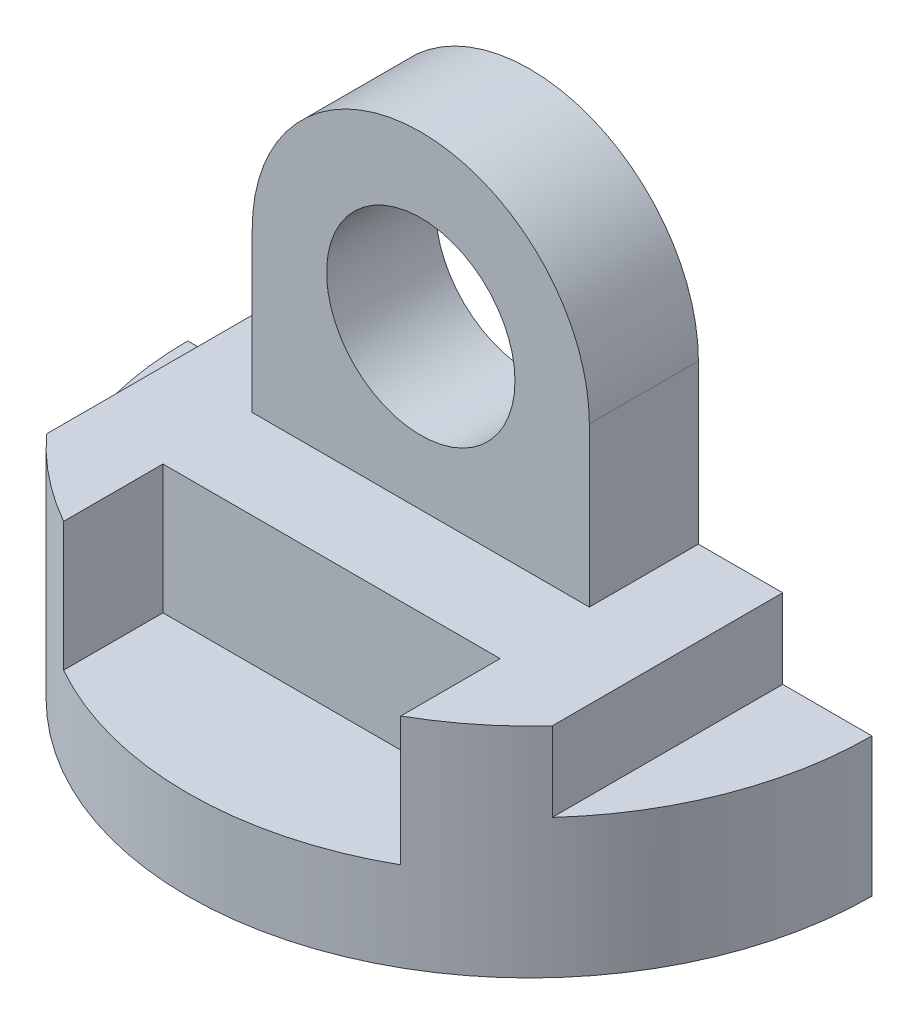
SolidWorks part; units mm, degrees
ref_plane "前视基准面" through (0, 0, 0) normal (0, 0, 1) x (1, 0, 0)
ref_plane "上视基准面" through (0, 0, 0) normal (0, 1, 0) x (1, 0, 0)
ref_plane "右视基准面" through (0, 0, 0) normal (1, 0, 0) x (0, 0, -1)
sketch "草图1" plane through (0, 0, 0) normal (0, 1, 0) x (1, 0, 0)
  line L0 (138, 0) -> (-138, 0)
  arc A0 (-138, 0) -> (138, 0) centre (0, 0) ccw
extrude "拉伸1" add sketch "草图1" along normal blind 88
sketch "草图2" plane through (0, 0, 0) normal (0, 0, 1) x (1, 0, 0)
  line L0 (138, 88) -> (-138, 88) construction
  line L1 (68, 88) -> (-68, 88)
  line L2 (68, 88) -> (68, 152)
  line L4 (-68, 88) -> (-68, 152)
  arc A0 (68, 152) -> (-68, 152) centre (0, 152) ccw
  dimension "D1" = 64
  dimension "D2" = 136
extrude "拉伸2" add sketch "草图2" along normal blind 44
sketch "草图3" plane through (0, 0, 44) normal (0, 0, 1) x (1, 0, 0)
  circle A0 centre (0, 152) radius 38
extrude "切除-拉伸3" cut sketch "草图3" against normal through all
sketch "草图4" plane through (0, 88, 0) normal (0, 1, 0) x (1, 0, 0)
  line L0 (-68, -80) -> (68, -80)
  line L1 (68, -80) -> (68, -157.9402)
  line L2 (68, -157.9402) -> (-68, -157.9402)
  line L3 (-68, -157.9402) -> (-68, -80)
  line L4 (0, -24.5189) -> (0, -58.3718) construction
  line L5 (-68, -44) -> (68, -44) construction
  dimension "D1" = 36
  dimension "D2" = 136
extrude "切除-拉伸4" cut sketch "草图4" against normal blind 52
sketch "草图5" plane through (0, 88, 0) normal (0, 1, 0) x (1, 0, 0)
  line L0 (-102, 10.1212) -> (-102, -104.4273)
  line L1 (-102, -104.4273) -> (-156.8486, -104.4273)
  line L2 (-156.8486, -104.4273) -> (-156.8486, 10.1212)
  line L3 (-156.8486, 10.1212) -> (-102, 10.1212)
  line L4 (-102, 10.1212) -> (-101.7394, 10.9084)
  dimension "D1" = 36
extrude "切除-拉伸5" cut sketch "草图5" against normal blind 32 contours L0 L1 L2 L3
mirror "镜向1" about plane through (0, 0, 0) normal (1, 0, 0) of "切除-拉伸5"
